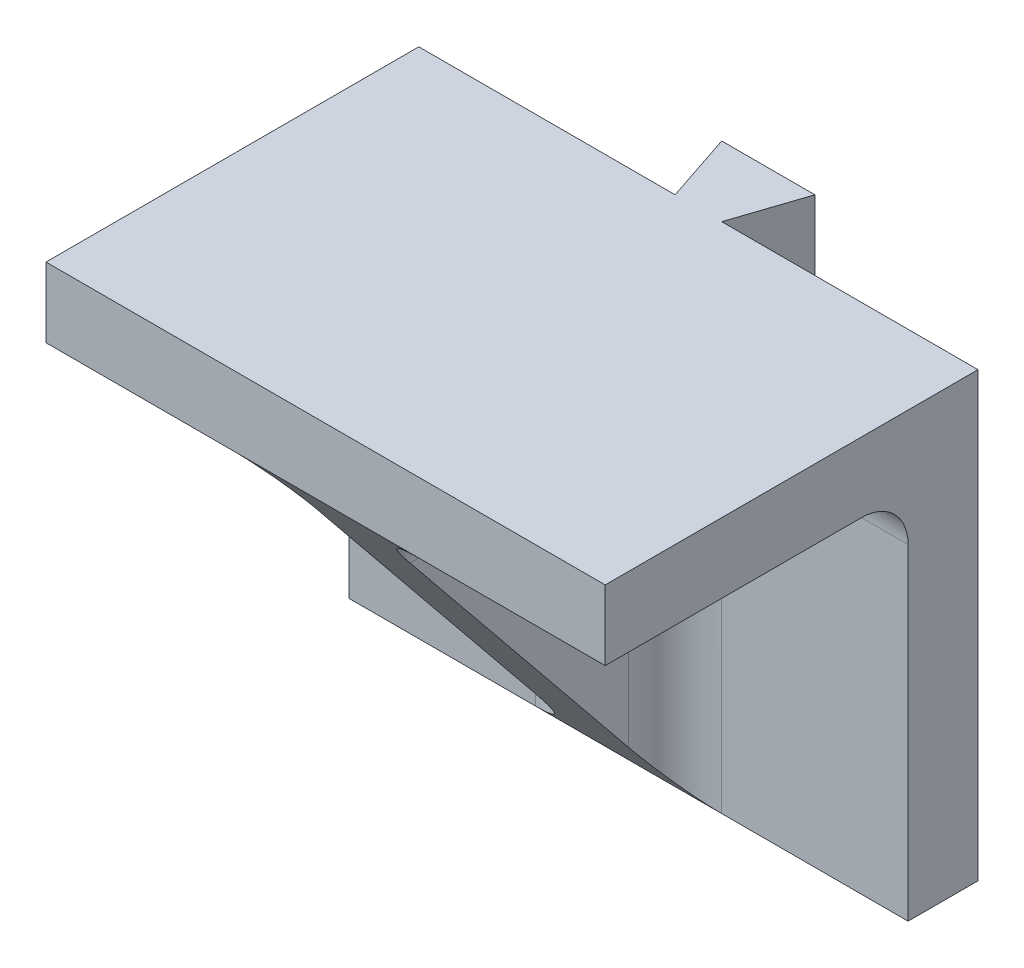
SolidWorks part; units mm, degrees
ref_plane "Front Plane" through (0, 0, 0) normal (0, 0, 1) x (1, 0, 0)
ref_plane "Top Plane" through (0, 0, 0) normal (0, 1, 0) x (1, 0, 0)
ref_plane "Right Plane" through (0, 0, 0) normal (1, 0, 0) x (0, 0, -1)
sketch "Sketch1" plane through (0, 0, 0) normal (0, 1, 0) x (1, 0, 0)
  line L1 (-76.2, 0) -> (76.2, 0)
  line L2 (-76.2, 0) -> (-76.2, -101.6)
  line L3 (-76.2, -101.6) -> (76.2, -101.6)
  line L4 (76.2, 0) -> (76.2, -101.6)
  dimension "D1" = 152.4
  dimension "D2" = 101.6
extrude "Extrude1" add sketch "Sketch1" against normal blind 19.05
sketch "Sketch2" plane through (76.2, 0, 0) normal (1, 0, 0) x (0, 0, -1)
  line L0 (-101.6, -19.05) -> (0, -19.05) construction
  line L1 (0, -19.05) -> (-19.05, -19.05)
  line L2 (0, -19.05) -> (0, -120.65)
  line L3 (0, -120.65) -> (-19.05, -120.65)
  line L4 (-19.05, -19.05) -> (-19.05, -120.65)
  line L5 (0, -19.05) -> (0, 0) construction
  line L6 (-101.6, 0) -> (0, 0) construction
extrude "Extrude2" add sketch "Sketch2" against normal up to vertex
sketch "Sketch3" plane through (0, 0, 0) normal (0, 1, 0) x (1, 0, 0)
  line L0 (6.35, 0) -> (12.7, 19.05)
  line L1 (76.2, 0) -> (-76.2, 0) construction
  line L2 (12.7, 19.05) -> (-12.7, 19.05)
  line L3 (0, 19.05) -> (0, 0) construction
  line L4 (-6.35, 0) -> (-12.7, 19.05)
  line L5 (-6.35, 0) -> (6.35, 0)
  dimension "D1" = 12.7
  dimension "D2" = 25.4
  dimension "D3" = 19.05
extrude "Extrude3" add sketch "Sketch3" against normal up to vertex
fillet "Fillet1" radius 12.7 1 edges
sketch "Sketch4" plane through (0, 0, 0) normal (1, 0, 0) x (0, 0, -1)
  line L0 (-101.6, -19.05) -> (-19.05, -120.65)
  line L1 (-101.6, -19.05) -> (-31.75, -19.05) construction
  line L2 (-19.05, -31.75) -> (-19.05, -120.65) construction
  line L3 (-101.6, -19.05) -> (-19.05, -19.05)
  line L4 (-19.05, -19.05) -> (-19.05, -120.65)
  line L7 (-19.05, -120.65) -> (0, -120.65) construction
extrude "Extrude4" add sketch "Sketch4" along normal mid plane 25.4
fillet "Fillet2" radius 12.7 6 edges at (-12.7, -19.05, 66.675) (-12.7, -22.7697, 22.7697) (12.7, -76.2, 19.05) (12.7, -22.7697, 22.7697) (-12.7, -76.2, 19.05) (12.7, -19.05, 66.675)
sketch "Sketch6" plane through (12.7, 0, 0) normal (1, 0, 0) x (0, 0, -1)
  line L0 (-101.6, -19.05) -> (-31.75, -19.05) construction
  line L1 (-19.05, -31.75) -> (-19.05, -120.65) construction
  circle A0 centre (-50.8, -50.8) radius 9.525
  dimension "D1" = 19.05
  dimension "D2" = 31.75
  dimension "D3" = 31.75
extrude "Cut-Extrude1" cut sketch "Sketch6" against normal through all
sketch "Sketch7" [suppressed] plane through (0, 0, 0) normal (1, 0, 0) x (0, 0, -1)
  line L0 (-50.8, -50.8) -> (-50.8, -60.325)
  line L1 (-50.8, -50.8) -> (-41.275, -50.8)
  circle A0 centre (-50.8, -50.8) radius 9.525 construction
